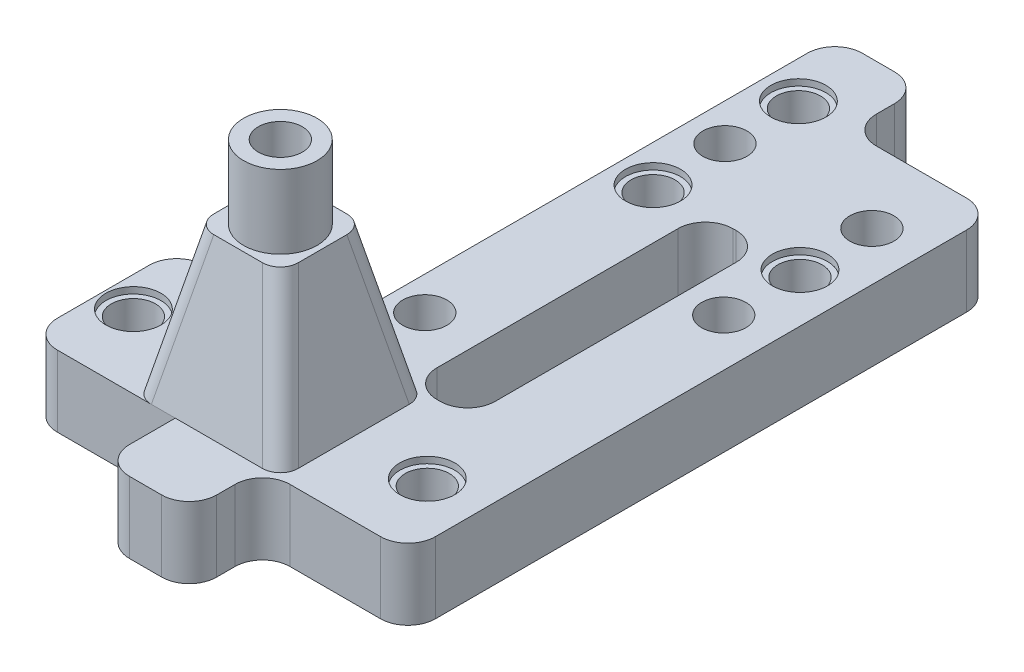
SolidWorks part; units mm, degrees
ref_plane "Front Plane" through (0, 0, 0) normal (0, 0, 1) x (1, 0, 0)
ref_plane "Top Plane" through (0, 0, 0) normal (0, 1, 0) x (1, 0, 0)
ref_plane "Right Plane" through (0, 0, 0) normal (1, 0, 0) x (0, 0, -1)
sketch "Sketch1" plane through (0, 0, 0) normal (0, 1, 0) x (1, 0, 0)
  line L0 (0, 0) -> (15.841, 0)
  line L1 (15.841, 0) -> (15.841, -7.985)
  line L2 (15.841, -7.985) -> (25.341, -7.985)
  line L3 (25.341, -7.985) -> (25.341, 0)
  line L4 (25.341, 0) -> (41.182, 0)
  line L5 (41.182, 0) -> (41.182, 63.83)
  line L6 (41.182, 63.83) -> (25.341, 63.83)
  line L7 (25.341, 63.83) -> (25.341, 71.815)
  line L8 (25.341, 71.815) -> (15.841, 71.815)
  line L9 (15.841, 71.815) -> (15.841, 16)
  line L10 (15.841, 16) -> (0, 16)
  line L11 (0, 16) -> (0, 0)
  dimension "D1" = 16
  dimension "D2" = 9.5
  dimension "D3" = 9.5
  dimension "D4" = 7.985
  dimension "D5" = 15.841
  dimension "D6" = 79.8
  dimension "D7" = 63.83
  dimension "D8" = 15.841
extrude "Boss-Extrude1" add sketch "Sketch1" along normal blind 7.75
sketch "Sketch2" plane through (0, 7.75, 0) normal (0, 1, 0) x (1, 0, 0)
  line L0 (25.341, 48.23) -> (31.681, 48.23)
  line L1 (31.681, 48.23) -> (31.681, 16)
  line L2 (31.681, 16) -> (25.341, 16)
  line L3 (25.341, 48.23) -> (25.341, 16)
  line L4 (15.841, 71.815) -> (15.841, 16) construction
  line L5 (25.341, 0) -> (41.182, 0) construction
  dimension "D1" = 6.34
  dimension "D2" = 9.5
  dimension "D3" = 32.23
  dimension "D4" = 16
extrude "Cut-Extrude1" cut sketch "Sketch2" against normal through all
sketch "Sketch3" plane through (0, 7.75, 0) normal (0, 1, 0) x (-1, 0, 0)
  line L0 (0, -8) -> (-44.5338, -8) construction
  line L1 (0, -16) -> (0, 0) construction
  line L2 (-9.8115, -55.81) -> (-51.1673, -55.81) construction
  line L3 (0, 0) -> (-15.841, 0) construction
  line L4 (-35.282, -72.908) -> (-35.282, 6.0722) construction
  line L5 (-41.182, 0) -> (-41.182, -63.83) construction
  line L6 (-19.282, -5.6) -> (-19.282, -75.0846) construction
  circle A0 centre (-3.282, -8) radius 2.4
  circle A1 centre (-35.282, -8) radius 2.4
  circle A2 centre (-19.282, -8) radius 2.4
  circle A3 centre (-19.882, -55.81) radius 2.4
  circle A4 centre (-35.882, -55.81) radius 2.4
  dimension "D4" = 16
  dimension "D5" = 16
  dimension "D6" = 0.6
  dimension "D7" = 16
  dimension "D8" = 4.8
  dimension "D9" = 4.8
  dimension "D1" = 8
  dimension "D2" = 47.81
  dimension "D3" = 5.9
extrude "Cut-Extrude2" cut sketch "Sketch3" against normal through all
sketch "Sketch4" plane through (0, 7.75, 0) normal (0, 1, 0) x (-1, 0, 0)
  circle A2 centre (-35.282, -8) radius 3
  circle A3 centre (-19.282, -8) radius 3
  circle A4 centre (-3.282, -8) radius 3
extrude "Cut-Extrude3" cut sketch "Sketch4" against normal blind 0.7
sketch "Sketch5" plane through (0, 0, 0) normal (0, -1, 0) x (1, 0, 0)
  circle A0 centre (3.282, -8) radius 3
  circle A1 centre (19.282, -8) radius 3
  circle A2 centre (35.282, -8) radius 3
extrude "Cut-Extrude4" cut sketch "Sketch5" against normal blind 0.7
fillet "Fillet2" radius 3 15 edges at (41.182, 3.875, 0) (41.182, 3.875, -63.83) (25.341, 3.875, -63.83) (31.681, 3.875, -48.23) (25.341, 3.875, -48.23) (25.341, 3.875, -16) (25.341, 3.875, 0) (25.341, 3.875, 7.985) (15.841, 3.875, 7.985) (0, 3.875, 0) (0, 3.875, -16) (15.841, 3.875, -16) (31.681, 3.875, -16) (25.341, 3.875, -71.815) (15.841, 3.875, -71.815)
sketch "Sketch6" plane through (0, 7.75, 0) normal (0, 1, 0) x (1, 0, 0)
  line L0 (7.3084, 23.53) -> (28.9619, 23.53) construction
  line L1 (0, 8) -> (44.5338, 8) construction
  line L2 (19.282, 5.6) -> (19.282, 75.0846) construction
  circle A0 centre (19.482, 23.53) radius 2.4
  dimension "D2" = 4.8
  dimension "D1" = 15.53
  dimension "D3" = 0.2
extrude "Cut-Extrude5" cut sketch "Sketch6" against normal through all
sketch "Sketch7" plane through (0, 7.75, 0) normal (0, 1, 0) x (-1, 0, 0)
  line L0 (-28.5559, -39.58) -> (-45.9787, -39.58) construction
  line L1 (-9.8115, -55.81) -> (-51.1673, -55.81) construction
  line L2 (-35.282, -72.908) -> (-35.282, 6.0722) construction
  circle A0 centre (-35.982, -39.58) radius 2.4
  dimension "D2" = 4.8
  dimension "D1" = 16.23
  dimension "D3" = 0.7
extrude "Cut-Extrude6" cut sketch "Sketch7" against normal through all
sketch "Sketch8" plane through (0, 7.75, 0) normal (0, 1, 0) x (-1, 0, 0)
  line L0 (-11.6605, -47.98) -> (-48.1562, -47.98) construction
  line L1 (-11.6605, -63.81) -> (-52.5357, -63.81) construction
  line L2 (-19.882, -68.7534) -> (-19.882, -42.3047) construction
  line L3 (-15.841, -68.815) -> (-15.841, -19) construction
  circle A0 centre (-19.882, -55.81) radius 2.4 construction
  circle A1 centre (-19.882, -47.98) radius 2.4
  circle A2 centre (-19.882, -63.81) radius 2.4
  circle A3 centre (-35.882, -47.98) radius 2.4
  dimension "D2" = 7.83
  dimension "D3" = 4.8
  dimension "D4" = 4.8
  dimension "D5" = 4.8
  dimension "D6" = 16
  dimension "D7" = 4.041
  dimension "D1" = 15.83
extrude "Cut-Extrude7" cut sketch "Sketch8" against normal through all
sketch "Sketch9" plane through (0, 7.75, 0) normal (0, 1, 0) x (-1, 0, 0)
  circle A0 centre (-19.882, -63.81) radius 3
  circle A1 centre (-19.882, -47.98) radius 3
  circle A2 centre (-35.882, -47.98) radius 3
  dimension "D1" = 6
  dimension "D2" = 6
  dimension "D3" = 6
extrude "Cut-Extrude8" cut sketch "Sketch9" against normal blind 0.7
sketch "Sketch10" plane through (0, 0, 0) normal (0, -1, 0) x (1, 0, 0)
  circle A0 centre (19.882, -63.81) radius 3
  circle A1 centre (19.882, -47.98) radius 3
  circle A2 centre (35.882, -47.98) radius 3
  dimension "D1" = 6
  dimension "D2" = 6
  dimension "D3" = 6
extrude "Cut-Extrude9" cut sketch "Sketch10" against normal blind 0.7
sketch "Sketch11" plane through (0, 7.75, 0) normal (0, 1, 0) x (1, 0, 0)
  line L0 (12.841, 16) -> (3, 16) construction
  line L1 (27.282, 0) -> (11.282, 0)
  line L2 (27.282, 0) -> (27.282, 16)
  line L3 (27.282, 16) -> (11.282, 16)
  line L4 (11.282, 0) -> (11.282, 16)
  line L5 (27.282, 0) -> (11.282, 16) construction
  line L6 (27.282, 16) -> (11.282, 0) construction
  point P0 (19.282, 8)
  dimension "D1" = 16
extrude "Boss-Extrude3" add sketch "Sketch11" along normal blind 16 draft 12
sketch "Sketch12" plane through (0, 23.75, 0) normal (0, 1, 0) x (-1, 0, 0)
  circle A0 centre (-19.282, -8) radius 4
  dimension "D1" = 8
extrude "Boss-Extrude4" add sketch "Sketch12" along normal blind 8
sketch "Sketch13" plane through (0, 31.75, 0) normal (0, 1, 0) x (1, 0, 0)
  circle A0 centre (19.282, 8) radius 2.4
  dimension "D1" = 4.8
extrude "Cut-Extrude10" cut sketch "Sketch13" against normal through all
fillet "Fillet3" radius 2 4 edges at (25.5815, 15.75, -14.2995) (25.5815, 15.75, -1.7005) (12.9825, 15.75, -1.7005) (12.9825, 15.75, -14.2995)
